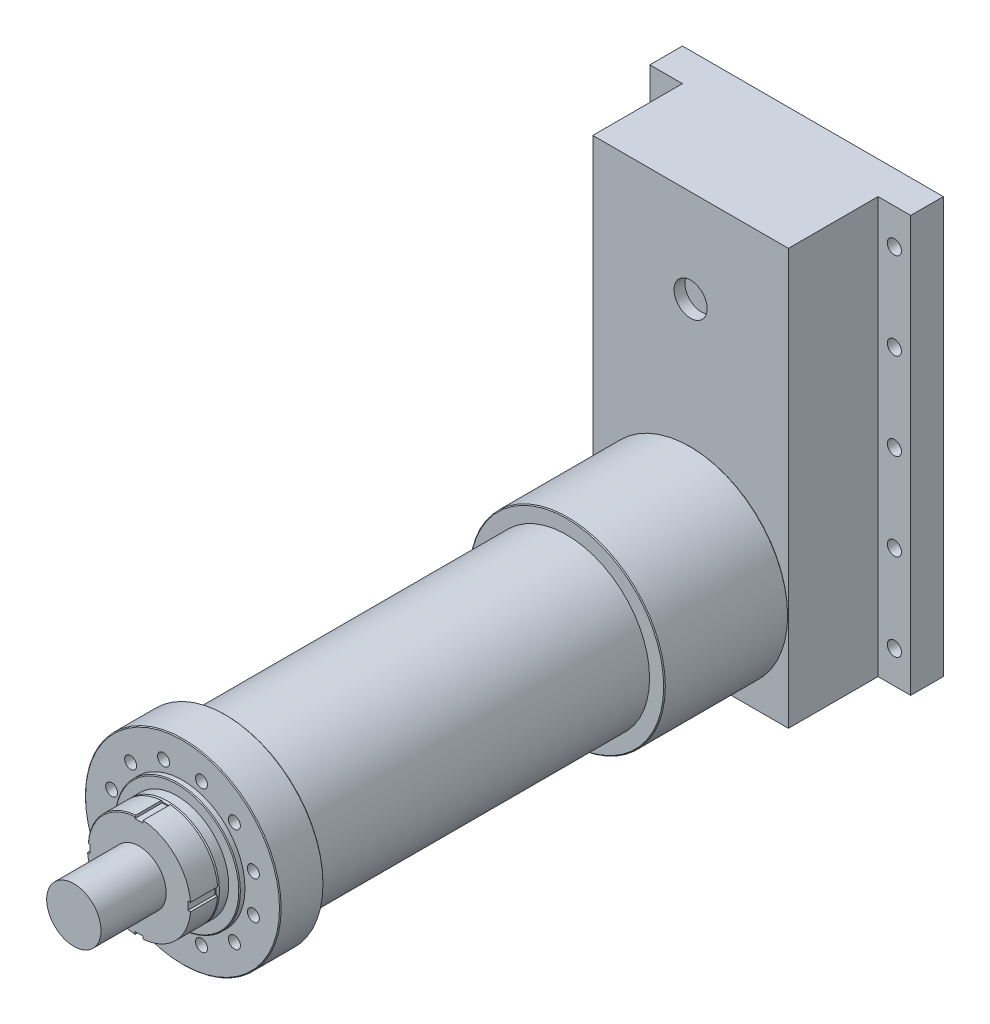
SolidWorks part; units mm, degrees
ref_plane "前视基准面" through (0, 0, 0) normal (0, 0, 1) x (1, 0, 0)
ref_plane "上视基准面" through (0, 0, 0) normal (0, 1, 0) x (1, 0, 0)
ref_plane "右视基准面" through (0, 0, 0) normal (1, 0, 0) x (0, 0, -1)
sketch "草图1" plane through (0, 0, 0) normal (0, 0, 1) x (1, 0, 0)
  circle A0 centre (0, 0) radius 152.5
  dimension "D1" = 305
extrude "凸台-拉伸1" add sketch "草图1" along normal blind 627
sketch "草图2" plane through (0, 0, 627) normal (0, 0, 1) x (1, 0, 0)
  line L0 (0, 0) -> (224.9367, 0) construction
  line L1 (0, 0) -> (223.5406, 59.8975) construction
  circle A0 centre (0, 0) radius 180
  circle A1 centre (0, 0) radius 135 construction
  circle A2 centre (130.4, 34.9406) radius 11
  circle A3 centre (130.4, -34.9406) radius 11
  circle A4 centre (95.4594, -95.4594) radius 11
  circle A5 centre (34.9406, -130.4) radius 11
  circle A6 centre (-34.9406, -130.4) radius 11
  circle A7 centre (-95.4594, -95.4594) radius 11
  circle A8 centre (-130.4, -34.9406) radius 11
  circle A9 centre (-130.4, 34.9406) radius 11
  circle A10 centre (-95.4594, 95.4594) radius 11
  circle A11 centre (-34.9406, 130.4) radius 11
  circle A12 centre (34.9406, 130.4) radius 11
  circle A13 centre (95.4594, 95.4594) radius 11
  point P32 (0, 0)
  dimension "D1" = 360
  dimension "D2" = 270
  dimension "D3" = 22
  dimension "D4" = 15
  dimension "D5" = 12
extrude "凸台-拉伸2" add sketch "草图2" along normal blind 80
sketch "草图3" plane through (0, 0, 707) normal (0, 0, 1) x (1, 0, 0)
  circle A0 centre (0, 0) radius 115
  dimension "D1" = 230
extrude "凸台-拉伸3" add sketch "草图3" along normal blind 10
sketch "草图4" plane through (0, 0, 717) normal (0, 0, 1) x (1, 0, 0)
  circle A0 centre (0, 0) radius 95
  dimension "D1" = 190
extrude "凸台-拉伸4" add sketch "草图4" along normal blind 20
chamfer "倒角1" distance 3 angle 45 1 edges at (95, 0, 737)
sketch "草图5" plane through (0, 0, 737) normal (0, 0, 1) x (1, 0, 0)
  line L0 (-7.5, 94.7035) -> (-7.5, 90)
  line L1 (-7.5, 90) -> (7.5, 90)
  line L2 (7.5, 90) -> (7.5, 94.7035)
  line L3 (94.7035, 7.5) -> (90, 7.5)
  line L4 (90, 7.5) -> (90, -7.5)
  line L5 (90, -7.5) -> (94.7035, -7.5)
  line L6 (7.5, -94.7035) -> (7.5, -90)
  line L7 (7.5, -90) -> (-7.5, -90)
  line L8 (-7.5, -90) -> (-7.5, -94.7035)
  line L9 (-94.7035, -7.5) -> (-90, -7.5)
  line L10 (-90, -7.5) -> (-90, 7.5)
  line L11 (-90, 7.5) -> (-94.7035, 7.5)
  arc A0 (-7.5, 94.7035) -> (-94.7035, 7.5) centre (0, 0) ccw
  arc A1 (-94.7035, -7.5) -> (-7.5, -94.7035) centre (0, 0) ccw
  arc A2 (7.5, -94.7035) -> (94.7035, -7.5) centre (0, 0) ccw
  arc A3 (94.7035, 7.5) -> (7.5, 94.7035) centre (0, 0) ccw
  point P21 (0, 0)
  dimension "D1" = 190
  dimension "D2" = 15
  dimension "D3" = 7.5
  dimension "D4" = 90
  dimension "D5" = 4
extrude "凸台-拉伸5" add sketch "草图5" along normal blind 50
chamfer "倒角2" distance 1.5 angle 45 5 edges at (180, 0, 627) (180, 0, 707) (115, 0, 717) (-67.1751, 67.1751, 737) (-67.1751, 67.1751, 787)
sketch "草图11" plane through (0, 0, 0) normal (0, 0, -1) x (-1, 0, 0)
  circle A0 centre (0, 0) radius 180
  dimension "D1" = 360
extrude "凸台-拉伸10" add sketch "草图11" along normal blind 228
chamfer "倒角5" distance 1.5 angle 45 2 edges at (-180, 0, 0) (-180, 0, -228)
sketch "草图12" plane through (0, 0, -228) normal (0, 0, -1) x (-1, 0, 0)
  line L0 (71.9375, 585) -> (180, 585)
  line L1 (-87.178, -180) -> (87.178, -180)
  line L2 (-180, -87.178) -> (-180, 420)
  line L3 (-71.9375, 585) -> (71.9375, 585)
  line L4 (180, -87.178) -> (180, 420)
  line L5 (180, 585) -> (180, 420)
  line L6 (-71.9375, 585) -> (-180, 585)
  line L7 (-180, 585) -> (-180, 420)
  line L8 (-180, -87.178) -> (-180, -180)
  line L9 (-180, -180) -> (-87.178, -180)
  line L10 (87.178, -180) -> (180, -180)
  line L11 (180, -180) -> (180, -87.178)
  dimension "D2" = 180
  dimension "D3" = 180
extrude "凸台-拉伸11" add sketch "草图12" along normal blind 165 separate body
ref_plane "基准面1" through (152.5, 0, 0) normal (1, 0, 0) x (0, 0, -1)
ref_plane "基准面2" through (-152.5, 0, 0) normal (1, 0, 0) x (0, 0, -1)
sketch "草图14" plane through (152.5, 0, 0) normal (1, 0, 0) x (0, 0, -1)
  circle A0 centre (-47, 0) radius 16
  dimension "D1" = 32
  dimension "D2" = 47
sketch "草图16" plane through (-152.5, 0, 0) normal (1, 0, 0) x (0, 0, -1)
  line L0 (0, 152.5) -> (0, -152.5) construction
  line L1 (-628.5, 180) -> (-628.5, -180) construction
  circle A0 centre (-27, 0) radius 16
  circle A1 centre (-551.5, 0) radius 16
  dimension "D1" = 32
  dimension "D2" = 27
  dimension "D3" = 32
  dimension "D4" = 77
extrude "切除-拉伸4" cut sketch "草图16" along normal blind 2
sketch "草图18" plane through (0, 0, -228) normal (0, 0, 1) x (1, 0, 0)
  circle A0 centre (0, 414) radius 30.4407
  dimension "D1" = 414
extrude "切除-拉伸6" cut sketch "草图18" against normal blind 20
sketch "草图19" plane through (0, 0, 787) normal (0, 0, 1) x (1, 0, 0)
  circle A0 centre (0, 0) radius 50
  dimension "D1" = 100
extrude "凸台-拉伸12" add sketch "草图19" along normal blind 120
sketch "草图23" plane through (0, 0, -393) normal (0, 0, -1) x (-1, 0, 0)
  line L0 (-180, -180) -> (180, -180) construction
  line L1 (-240, 585) -> (240, 585)
  line L2 (-240, 585) -> (-240, -180)
  line L3 (-240, -180) -> (240, -180)
  line L4 (240, 585) -> (240, -180)
  line L5 (-240, 585) -> (240, -180) construction
  line L6 (-240, -180) -> (240, 585) construction
  line L7 (0, 202.5) -> (0, 147.4834) construction
  circle A0 centre (-210, 520) radius 13
  circle A1 centre (-210, 360) radius 13
  circle A2 centre (-210, 200) radius 13
  circle A3 centre (-210, 40) radius 13
  circle A4 centre (-210, -120) radius 13
  circle A5 centre (210, -120) radius 13
  circle A6 centre (210, 40) radius 13
  circle A7 centre (210, 200) radius 13
  circle A8 centre (210, 360) radius 13
  circle A9 centre (210, 520) radius 13
  point P0 (0, 202.5)
  dimension "D3" = 26
  dimension "D1" = 765
  dimension "D2" = 480
  dimension "D4" = 60
  dimension "D5" = 160
  dimension "D6" = 160
  dimension "D7" = 160
  dimension "D8" = 160
  dimension "D9" = 210
extrude "凸台-拉伸16" add sketch "草图23" along normal blind 60
